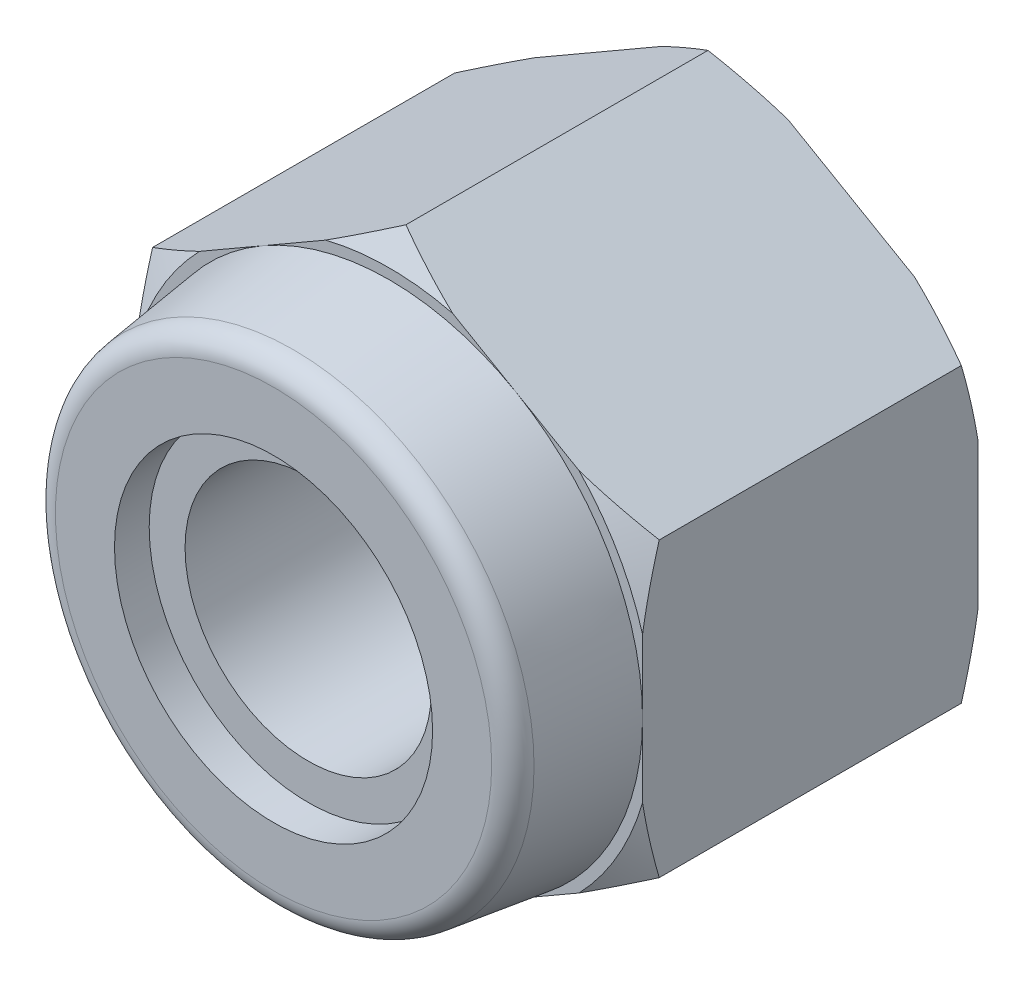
SolidWorks part; units mm, degrees
ref_plane "Front" through (0, 0, 0) normal (0, 0, 1) x (1, 0, 0)
ref_plane "Top" through (0, 0, 0) normal (0, 1, 0) x (1, 0, 0)
ref_plane "Right" through (0, 0, 0) normal (1, 0, 0) x (0, 0, -1)
sketch "BaseNutSke" plane through (0, 0, 0) normal (0, 0, 1) x (1, 0, 0)
  line L1 (5.5626, -3.2116) -> (5.5626, 3.2116)
  line L2 (5.5626, 3.2116) -> (0, 6.4231)
  line L3 (0, 6.4231) -> (-5.5626, 3.2116)
  line L4 (-5.5626, 3.2116) -> (-5.5626, -3.2116)
  line L5 (-5.5626, -3.2116) -> (0, -6.4231)
  line L12 (0, -6.4231) -> (5.5626, -3.2116)
  circle A0 centre (0, 0) radius 2.7051
  circle A2 centre (0, 0) radius 5.5626 construction
  dimension "Tap_Drill" = 5.4102
  dimension "A" = 11.1252
extrude "BaseNut" add sketch "BaseNutSke" against normal blind 7.366
sketch "TorqEleSke" plane through (0, 0, 0) normal (0, 1, 0) x (0, 0, -1)
  line L0 (-9.4809, 0) -> (15.875, 0) construction
  line L1 (0, 0) -> (0, 5.5626) construction
  line L2 (-1.778, 3.4925) -> (-1.778, 2.7051)
  line L3 (0, 2.7051) -> (0, 5.5626)
  line L4 (0, 5.5626) -> (-2.1053, 5.2854)
  line L5 (-1.778, 2.7051) -> (0, 2.7051)
  line L6 (-1.778, 3.4925) -> (-2.54, 3.4925)
  line L7 (-2.54, 3.4925) -> (-2.54, 4.7897)
  line L10 (0, -5.5626) -> (0, 0) construction
  line L11 (7.366, -5.5626) -> (7.366, 0) construction
  arc A0 (-2.54, 4.7897) -> (-2.1053, 5.2854) centre (-2.04, 4.7897) cw
revolve "TorqueElement" add sketch "TorqEleSke" angle 360 about L0
sketch "Sketch3" plane through (0, 0, 0) normal (1, 0, 0) x (0, 0, -1)
  line L0 (7.366, 5.7881) -> (6.9994, 6.4231)
  line L1 (0, 6.4231) -> (0, 5.7881)
  line L2 (6.9994, 6.4231) -> (7.366, 6.4231)
  line L3 (7.366, 6.4231) -> (7.366, 5.7881)
  line L4 (0.3666, 6.4231) -> (0, 6.4231)
  line L5 (0, 5.7881) -> (0.3666, 6.4231)
  line L7 (0, 0) -> (38.6776, 0) construction
  line L9 (3.683, 4.0415) -> (3.683, 50004.0415) construction
  line L15 (7.366, 6.4231) -> (0, 6.4231) construction
  point P23 (3.683, 6.4231)
revolve "DoubleChamfer" cut sketch "Sketch3" angle 360 about L7
sketch "ThdSchSke" plane through (0, 0, 0) normal (0, 1, 0) x (1, 0, 0)
  line L0 (-3.175, 7.366) -> (-2.7051, 7.6373)
  line L1 (-3.175, 7.366) -> (-50003.175, 7.366) construction
  line L2 (-2.7051, 7.6373) -> (-2.7051, 7.0947)
  line L3 (2.7051, 7.366) -> (-2.7051, 7.366) construction
  line L4 (-2.7051, 7.0947) -> (-3.175, 7.366)
  line L6 (0, -1.4815) -> (0, -2.9874) construction
  line L7 (-2.7051, 7.366) -> (-2.7051, -1.778) construction
revolve "ThreadSchematic" cut sketch "ThdSchSke" angle 360 about L6
pattern_linear "ThdSchPat" [suppressed]
equation "\"Inset_Dia@TorqEleSke\" = \"ThreadSize@ThdSchSke\" * 1.1"
equation "\"D3@TorqEleSke\" = \"ThreadSize@ThdSchSke\" * .12"
equation "\"ChamferLen@Sketch3\"=\"ThreadSize@ThdSchSke\"*.1"
